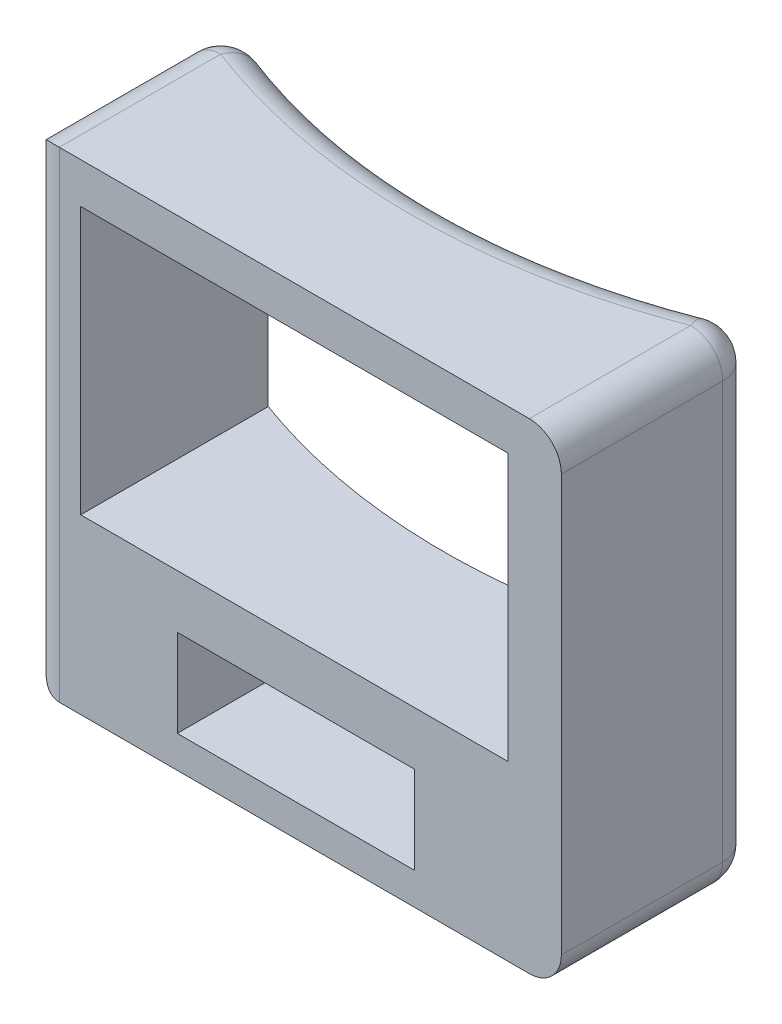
SolidWorks part; units mm, degrees
ref_plane "前视基准面" through (0, 0, 0) normal (0, 0, 1) x (1, 0, 0)
ref_plane "上视基准面" through (0, 0, 0) normal (0, 1, 0) x (1, 0, 0)
ref_plane "右视基准面" through (0, 0, 0) normal (1, 0, 0) x (0, 0, -1)
sketch "草图1" plane through (0, 0, 0) normal (0, 1, 0) x (1, 0, 0)
  line L2 (-25, -52.3355) -> (-25, -78)
  line L3 (-25, -78) -> (25, -78)
  line L4 (25, -52.3355) -> (25, -78)
  line L5 (-25, -38) -> (25, -78) construction
  line L6 (-25, -78) -> (25, -38) construction
  arc A0 (-25, -52.3355) -> (25, -52.3355) centre (0, 0) ccw
  point P3 (0, -58)
  dimension "D1" = 116
  dimension "D2" = 50
  dimension "D3" = 40
extrude "凸台-拉伸1" add sketch "草图1" along normal blind 45
sketch "草图2" plane through (0, 0, 78) normal (0, 0, 1) x (1, 0, 0)
  line L0 (-25, 0) -> (25, 0) construction
  line L1 (-10.9562, 11.2) -> (11.2438, 11.2)
  line L2 (-10.9562, 11.2) -> (-10.9562, 3)
  line L3 (-10.9562, 3) -> (11.2438, 3)
  line L4 (11.2438, 11.2) -> (11.2438, 3)
  line L5 (-10.9562, 11.2) -> (11.2438, 3) construction
  line L6 (-10.9562, 3) -> (11.2438, 11.2) construction
  point P0 (0.1438, 7.1)
  dimension "D1" = 22.2
  dimension "D2" = 8.2
  dimension "D3" = 3
extrude "切除-拉伸1" cut sketch "草图2" against normal through all
sketch "草图3" plane through (0, 0, 78) normal (0, 0, 1) x (1, 0, 0)
  line L0 (11.2438, 11.2) -> (-10.9562, 11.2) construction
  line L1 (-20, 41.2) -> (20, 41.2)
  line L2 (-20, 41.2) -> (-20, 16.2)
  line L3 (-20, 16.2) -> (20, 16.2)
  line L4 (20, 41.2) -> (20, 16.2)
  line L5 (-20, 41.2) -> (20, 16.2) construction
  line L6 (-20, 16.2) -> (20, 41.2) construction
  point P0 (0, 28.7)
  point P6 (0, 0)
  dimension "D1" = 40
  dimension "D2" = 25
  dimension "D3" = 5
extrude "切除-拉伸2" cut sketch "草图3" against normal through all
sketch "草图4" plane through (0, 0, 78) normal (0, 0, 1) x (1, 0, 0)
  line L4 (-25, 0) -> (25, 0)
  line L5 (25, 0) -> (25, 45)
  line L6 (25, 45) -> (-25, 45)
  line L7 (-25, 45) -> (-25, 0)
  line L8 (-25, 0) -> (25, 0)
  line L9 (25, 0) -> (25, 45)
  line L10 (25, 45) -> (-25, 45)
  line L11 (-25, 45) -> (-25, 0)
  dimension "D1" = 0
extrude "切除-拉伸3" cut sketch "草图4" against normal blind 6
fillet "圆角1" radius 3 9 edges at (-25, 0, 62.1677) (-25, 22.5, 52.3355) (-25, 45, 62.1677) (-25, 22.5, 72) (25, 22.5, 52.3355) (0, 0, 58) (0, 45, 58) (25, 45, 62.1677) (25, 0, 62.1677)
